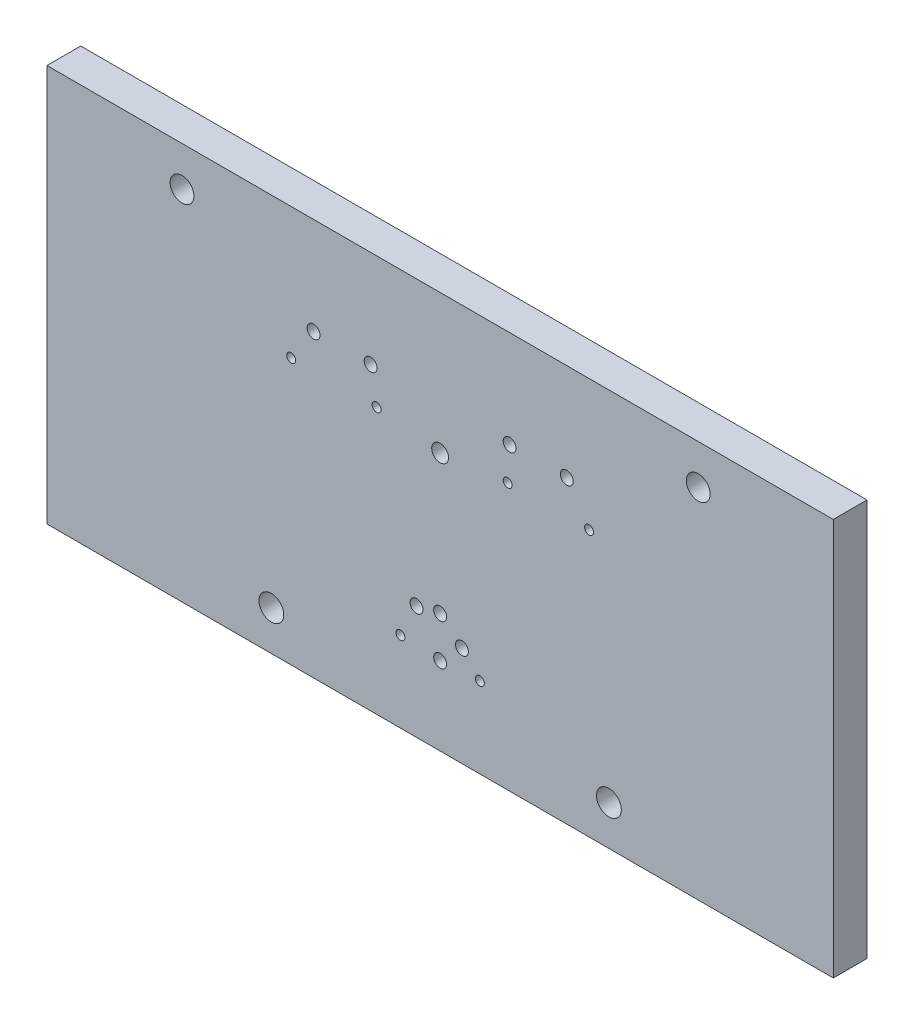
SolidWorks part; units mm, degrees
ref_plane "Plan de face" through (0, 0, 0) normal (0, 0, 1) x (1, 0, 0)
ref_plane "Plan de dessus" through (0, 0, 0) normal (0, 1, 0) x (1, 0, 0)
ref_plane "Plan de droite" through (0, 0, 0) normal (1, 0, 0) x (0, 0, -1)
imported_body "Importée1"
sketch "Esquisse1" plane through (0, 0, -143) normal (0, 0, -1) x (-1, 0, 0)
  circle A0 centre (28.5, -19.515) radius 6
  circle A1 centre (-30.5, -19.015) radius 5.5
  dimension "D1" = 12
  dimension "D2" = 11
extrude "Extrusion1" add sketch "Esquisse1" against normal up to surface (5 mm away)
sketch "Esquisse2" plane through (0, 0, -143) normal (0, 0, -1) x (-1, 0, 0)
  circle A0 centre (80, 36.261) radius 4
  circle A1 centre (36, 36.261) radius 4
  circle A2 centre (0, 30) radius 6
  circle A3 centre (-36, 36.261) radius 4
  circle A4 centre (-80, 36.261) radius 4
  dimension "D1" = 8
  dimension "D2" = 8
  dimension "D3" = 12
  dimension "D4" = 8
  dimension "D5" = 8
extrude "Extrusion2" add sketch "Esquisse2" against normal up to surface (5 mm away)
sketch "Esquisse3" plane through (0, 0, -126) normal (0, 0, 1) x (1, 0, 0)
  circle A0 centre (80, 36.261) radius 2.25
  circle A1 centre (36, 36.261) radius 2.25
  circle A2 centre (0, 30) radius 3.25
  circle A3 centre (-36, 36.261) radius 2.25
  circle A4 centre (-80, 36.261) radius 2.25
  circle A5 centre (-28.5, -19.515) radius 3.25
  circle A6 centre (30.5, -19.015) radius 2.75
  dimension "D1" = 5.5
  dimension "D2" = 6.5
  dimension "D3" = 4.5
  dimension "D4" = 4.5
  dimension "D5" = 6.5
  dimension "D6" = 4.5
  dimension "D7" = 4.5
extrude "Extrusion3" add sketch "Esquisse3" against normal up to surface (12 mm away)
sketch "Esquisse4" plane through (0, 0, -126) normal (0, 0, 1) x (1, 0, 0)
  circle A0 centre (75, 33.9925) radius 2 construction
  circle A1 centre (75, 33.9925) radius 2
  circle A2 centre (34, 33.9925) radius 2 construction
  circle A3 centre (34, 33.9925) radius 2
  circle A4 centre (-75, 33.9925) radius 2 construction
  circle A5 centre (-32, 33.9925) radius 2 construction
  circle A6 centre (0, 30) radius 4 construction
  circle A7 centre (-75, 33.9925) radius 2
  circle A8 centre (-32, 33.9925) radius 2
  circle A9 centre (0, 30) radius 4
extrude "Enlèv. mat.-Extru.1" cut sketch "Esquisse4" against normal through all
sketch "Esquisse5" plane through (0, 0, -126) normal (0, 0, 1) x (1, 0, 0)
  circle A0 centre (75, 33.9925) radius 2.25
  circle A1 centre (34, 33.9925) radius 2.25
  circle A2 centre (0, 30) radius 4.25
  circle A3 centre (-32, 33.9925) radius 2.25
  circle A4 centre (-75, 33.9925) radius 2.25
  dimension "D1" = 4.5
  dimension "D2" = 4.5
  dimension "D3" = 4.5
  dimension "D4" = 4.5
  dimension "D5" = 8.5
extrude "Extrusion4" cut sketch "Esquisse5" against normal through all
sketch "Esquisse6" plane through (0, 0, -143) normal (0, 0, -1) x (-1, 0, 0)
  circle A0 centre (75, 33.9925) radius 4
  circle A1 centre (32, 33.9925) radius 4
  circle A2 centre (-34, 33.9925) radius 4
  circle A4 centre (-75, 33.9925) radius 4
  dimension "D1" = 8
  dimension "D2" = 8
  dimension "D3" = 8
  dimension "D4" = 8
extrude "Extrusion5" cut sketch "Esquisse6" against normal blind 3
sketch "Esquisse7" plane through (0, 0, -143) normal (0, 0, -1) x (-1, 0, 0)
  circle A0 centre (0, 30) radius 6
  dimension "D1" = 12
extrude "Extrusion6" cut sketch "Esquisse7" against normal blind 5
